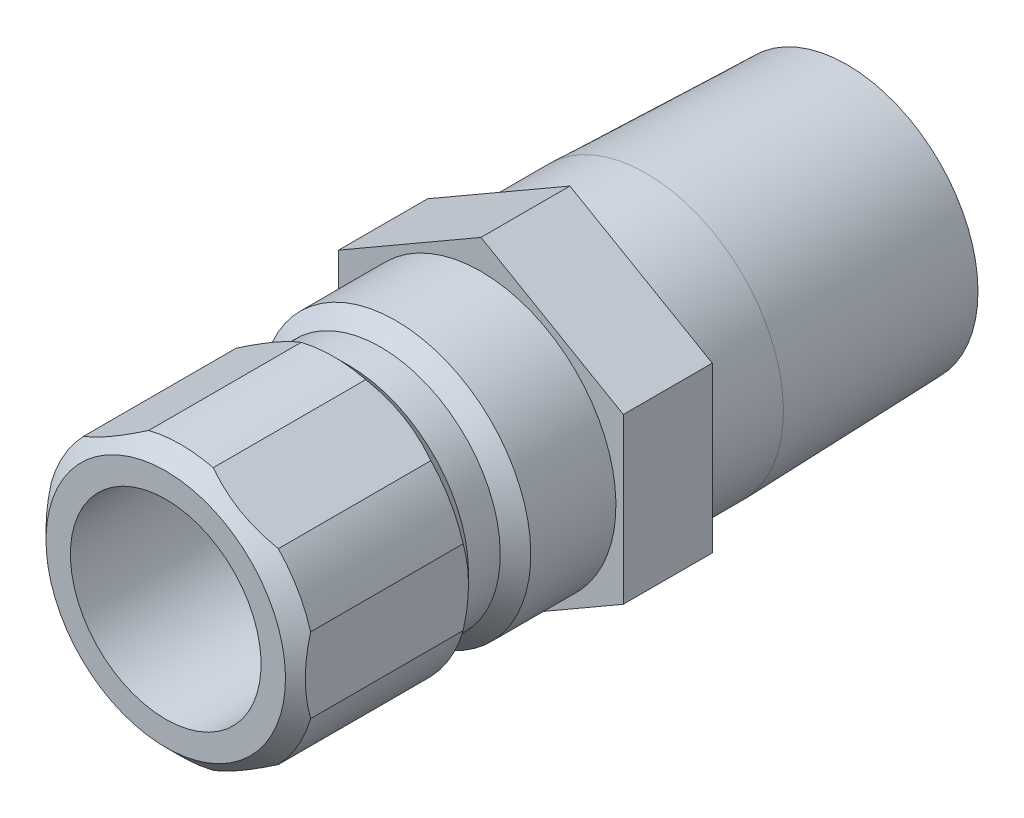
SolidWorks part; units mm, degrees
ref_plane "Front Plane" through (0, 0, 0) normal (0, 0, 1) x (1, 0, 0)
ref_plane "Top Plane" through (0, 0, 0) normal (0, 1, 0) x (1, 0, 0)
ref_plane "Right Plane" through (0, 0, 0) normal (1, 0, 0) x (0, 0, -1)
sketch "Sketch1" plane through (0, 0, 0) normal (1, 0, 0) x (0, 0, -1)
  line L0 (0, 0) -> (-18.923, 0) construction
  line L1 (-15.748, 4.7625) -> (-15.748, 5.9817)
  line L2 (-6.604, 5.9817) -> (-6.604, 0) construction
  line L3 (-14.986, 6.7437) -> (-7.366, 6.7437)
  line L4 (0, 6.858) -> (0, 0) construction
  line L5 (-6.604, 5.9817) -> (-5.0165, 5.9817)
  line L6 (-4.2545, 6.7437) -> (0, 6.7437)
  line L7 (0, 6.7437) -> (0, 6.858)
  line L8 (-6.604, 5.9817) -> (-7.366, 6.7437)
  line L9 (-5.0165, 5.9817) -> (-4.2545, 6.7437)
  line L10 (-15.748, 5.9817) -> (-14.986, 6.7437)
  line L11 (-15.748, 4.7625) -> (-3.556, 4.7625)
  line L12 (0, 6.858) -> (8.255, 6.858)
  line L13 (8.255, 6.858) -> (18.288, 6.5445)
  line L14 (18.288, 6.5445) -> (18.288, 4.6228)
  line L15 (0, 0) -> (4.445, 0) construction
  line L17 (-3.4817, 4.6228) -> (18.288, 4.6228)
  line L18 (-3.556, 4.7625) -> (-3.4817, 4.6228)
  dimension "D1" = 15.748
  dimension "D2" = 1.5875
  dimension "D3" = 0.762
  dimension "D4" = 45
  dimension "D5" = 9.144
  dimension "D6" = 45
  dimension "D7" = 1.79
  dimension "D8" = 10.033
  dimension "D9" = 34.036
  dimension "D10" = 3.175
  dimension "D11" = 9.525
  dimension "D12" = 13.716
  dimension "D13" = 4.445
  dimension "D14" = 13.4874
  dimension "D15" = 9.2456
  dimension "D16" = 12.192
  dimension "D17" = 118
revolve "Revolve1" add sketch "Sketch1" angle 360 about L0
sketch "Sketch2" plane through (0, 0, 0) normal (0, 0, 1) x (1, 0, 0)
  line L1 (-7.112, 4.1061) -> (-7.112, -4.1061)
  line L2 (-7.112, -4.1061) -> (0, -8.2122)
  line L3 (0, -8.2122) -> (7.112, -4.1061)
  line L4 (7.112, -4.1061) -> (7.112, 4.1061)
  line L5 (7.112, 4.1061) -> (0, 8.2122)
  line L6 (0, 8.2122) -> (-7.112, 4.1061)
  circle A0 centre (0, 0) radius 7.112 construction
  circle A1 centre (0, 0) radius 4.6228 construction
  circle A2 centre (0, 0) radius 4.6228
  dimension "D1" = 14.224
extrude "Boss-Extrude1" add sketch "Sketch2" against normal up to vertex (4.445 mm away)
sketch "Sketch3" plane through (0, 0, 0) normal (0, 0, 1) x (1, 0, 0)
  line L1 (-6.477, 3.7395) -> (-6.477, -3.7395)
  line L2 (-6.477, -3.7395) -> (0, -7.479)
  line L3 (0, -7.479) -> (6.477, -3.7395)
  line L4 (6.477, -3.7395) -> (6.477, 3.7395)
  line L5 (6.477, 3.7395) -> (0, 7.479)
  line L6 (0, 7.479) -> (-6.477, 3.7395)
  circle A0 centre (0, 0) radius 6.477 construction
  circle A1 centre (0, 0) radius 4.6228 construction
  circle A2 centre (0, 0) radius 4.6228
  dimension "D1" = 12.954
extrude "Cut-Extrude1" cut sketch "Sketch3" along normal through all from vertex at 6.604 flip side to cut
